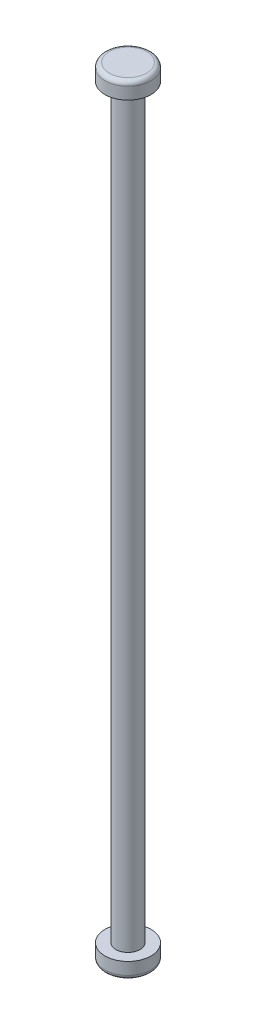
SolidWorks part; units mm, degrees
ref_plane "Front Plane" through (0, 0, 0) normal (0, 0, 1) x (1, 0, 0)
ref_plane "Top Plane" through (0, 0, 0) normal (0, 1, 0) x (1, 0, 0)
ref_plane "Right Plane" through (0, 0, 0) normal (1, 0, 0) x (0, 0, -1)
sketch "Sketch18" plane through (0, 0, 0) normal (0, 1, 0) x (1, 0, 0)
  circle A0 centre (0, 0) radius 0.55
  dimension "D1" = 1.1
extrude "Boss-Extrude1" add sketch "Sketch18" along normal mid plane 34
sketch "Sketch19" plane through (0, 17, 0) normal (0, 1, 0) x (1, 0, 0)
  circle A0 centre (0, 0) radius 1.05
  circle A1 centre (0, 0) radius 0.55 construction
  dimension "D1" = 0.5
extrude "Boss-Extrude2" add sketch "Sketch19" along normal blind 0.75
mirror "Mirror1" about plane through (0, 0, 0) normal (0, 1, 0) of "Boss-Extrude2"
fillet "Fillet2" radius 0.2 1 edges at (0, 17.75, 1.05)
fillet "Fillet3" radius 0.2 1 edges at (0, -17.75, 1.05)
scale "Scale1" scale about centroid uniform scaling yes scale factor 0.7
